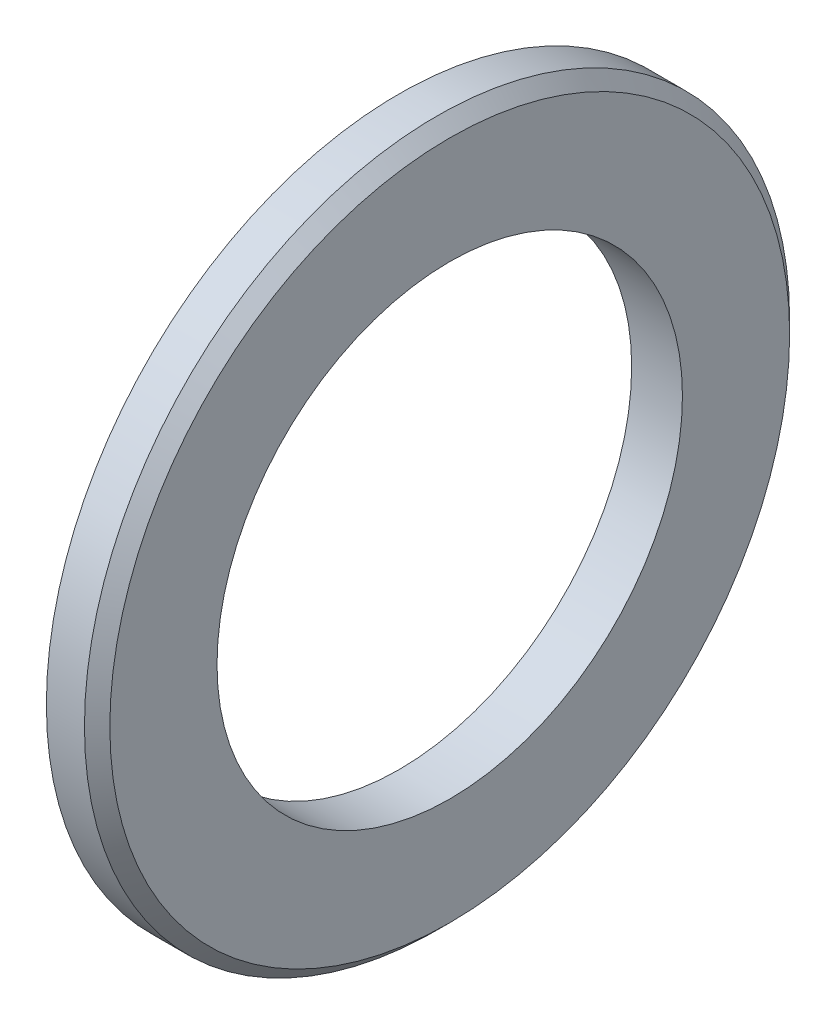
SolidWorks part; units mm, degrees
ref_plane "Plane1" through (0, 0, 0) normal (0, 0, 1) x (1, 0, 0)
ref_plane "Plane2" through (0, 0, 0) normal (0, 1, 0) x (1, 0, 0)
ref_plane "Plane3" through (0, 0, 0) normal (1, 0, 0) x (0, 0, -1)
sketch "Sketch1" plane through (0, 0, 0) normal (0, 0, 1) x (1, 0, 0)
  line L0 (-34.925, 0) -> (9.525, 0) construction
  line L1 (0, 82.5) -> (0, 125)
  line L2 (0, 125) -> (-18, 125)
  line L3 (-18, 125) -> (-18, 82.5)
  line L4 (-18, 82.5) -> (0, 82.5)
  dimension "Thickness" = 18
  dimension "Inside_dia" = 165
  dimension "Outside_dia" = 250
revolve "Base-Revolve" add sketch "Sketch1" angle 360 about L0
chamfer "ODChamfer" distance 4.5 angle 45 1 edges at (0, 0, 125)
equation "\"D1@ODChamfer\" =  \"Thickness@Sketch1\" * 0.25"
